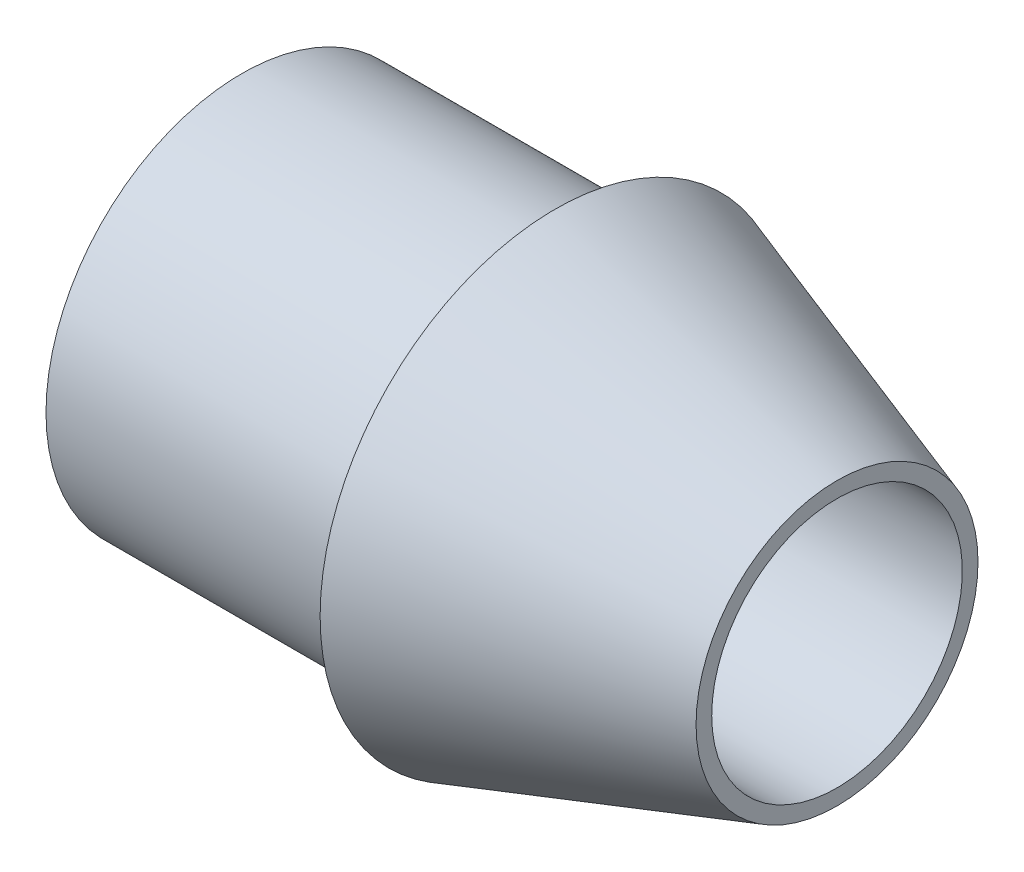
SolidWorks part; units mm, degrees
ref_plane "Plan1" through (0, 0, 0) normal (0, 0, 1) x (1, 0, 0)
ref_plane "Plan2" through (0, 0, 0) normal (0, 1, 0) x (1, 0, 0)
ref_plane "Plan3" through (0, 0, 0) normal (1, 0, 0) x (0, 0, -1)
sketch "Esquisse1" plane through (0, 0, 0) normal (0, 0, 1) x (1, 0, 0)
  line L0 (0, 0) -> (-22.5, 0)
  line L1 (-22.5, 0) -> (-22.5, 7.5)
  line L2 (-22.5, 7.5) -> (0, 0)
  line L3 (-31, 0) -> (12, 0) construction
  dimension "D1" = 22.5
  dimension "D2" = 7.5
revolve "Base-Révolution" add sketch "Esquisse1" angle 360 about L3
ref_plane "Plan4" through (-13.5, 0, 0) normal (1, 0, 0) x (0, 0, -1)
sketch "Esquisse2" plane through (-13.5, 0, 0) normal (1, 0, 0) x (0, 0, -1)
  circle A0 centre (0, 0) radius 6
  dimension "D1" = 12
extrude "Enlèv. mat.-Extru.1" cut sketch "Esquisse2" along normal through all
sketch "Esquisse3" plane through (-22.5, 0, 0) normal (-1, 0, 0) x (0, 0, 1)
  circle A0 centre (0, 0) radius 6.25
  dimension "D1" = 12.5
extrude "Boss.-Extru.1" add sketch "Esquisse3" along normal blind 10
sketch "Esquisse4" plane through (-32.5, 0, 0) normal (-1, 0, 0) x (0, 0, 1)
  circle A0 centre (0, 0) radius 4
  dimension "D1" = 8
extrude "Enlèv. mat.-Extru.2" cut sketch "Esquisse4" against normal through all
